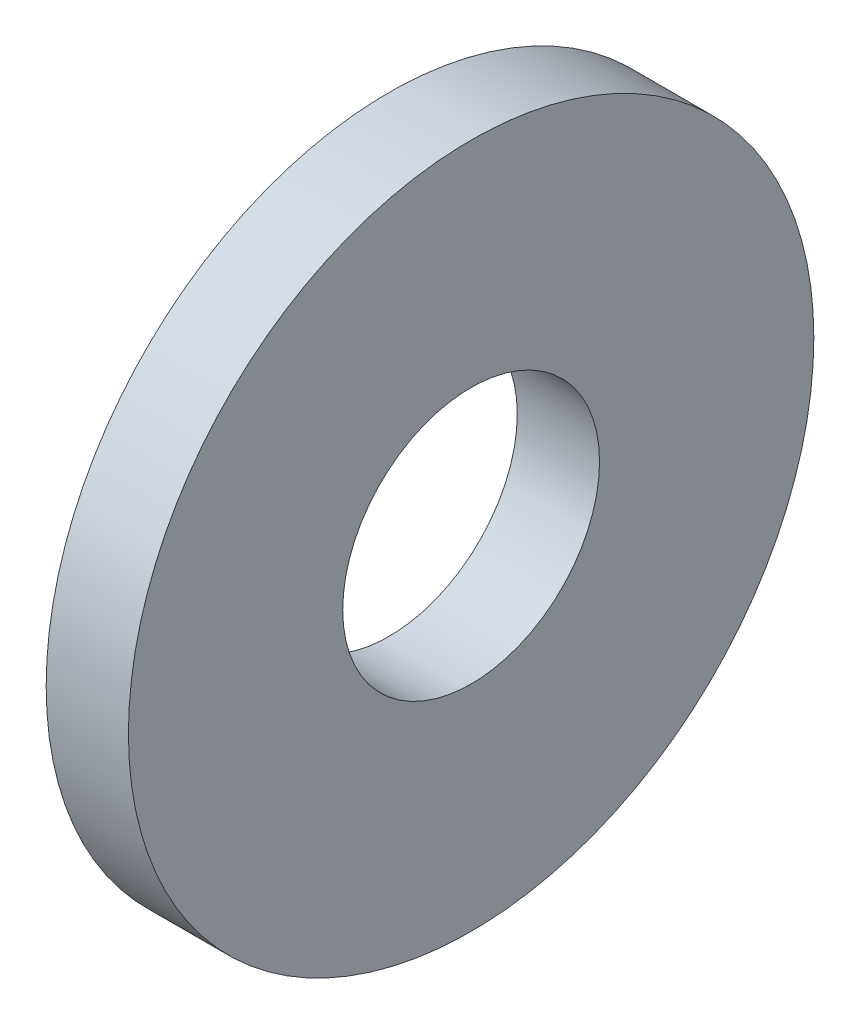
SolidWorks part; units mm, degrees
ref_plane "Front Plane" through (0, 0, 0) normal (0, 0, 1) x (1, 0, 0)
ref_plane "Top Plane" through (0, 0, 0) normal (0, 1, 0) x (1, 0, 0)
ref_plane "Right Plane" through (0, 0, 0) normal (1, 0, 0) x (0, 0, -1)
sketch "Sketch1" plane through (0, 0, 0) normal (1, 0, 0) x (0, 0, -1)
  circle A0 centre (0, 0) radius 9.525
  circle A1 centre (0, 0) radius 3.5687
  dimension "OD" = 19.05
  dimension "ID" = 7.1374
extrude "Boss-Extrude1" add sketch "Sketch1" along normal blind 2.286
